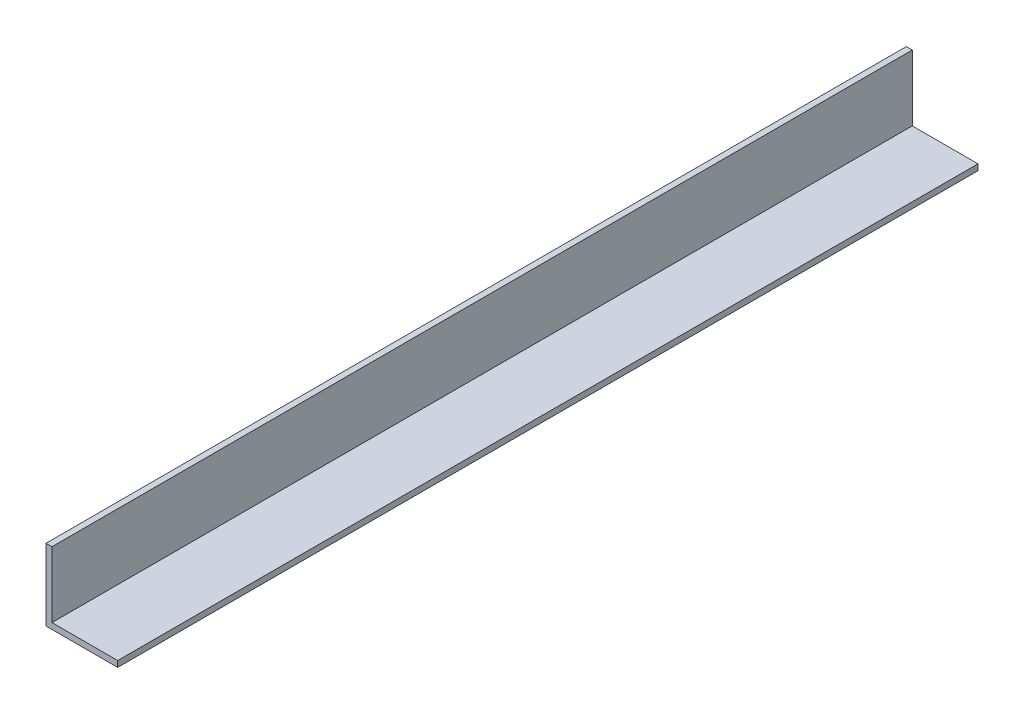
SolidWorks part; units mm, degrees
ref_plane "Plane1" through (0, 0, 0) normal (0, 0, 1) x (1, 0, 0)
ref_plane "Plane2" through (0, 0, 0) normal (0, 1, 0) x (1, 0, 0)
ref_plane "Plane3" through (0, 0, 0) normal (1, 0, 0) x (0, 0, -1)
sketch "Sketch1" plane through (0, 0, 0) normal (0, 0, 1) x (1, 0, 0)
  line L0 (0, 38.1) -> (0, 0)
  line L1 (0, 0) -> (38.1, 0)
  line L2 (3.175, 3.175) -> (38.1, 3.175)
  line L3 (3.175, 38.1) -> (3.175, 3.175)
  line L4 (0, 38.1) -> (3.175, 38.1)
  line L5 (38.1, 0) -> (38.1, 3.175)
  dimension "D2" = 38.1
  dimension "D3" = 38.1
  dimension "D1" = 3.175
extrude "Base-Extrude" add sketch "Sketch1" along normal blind 457.2
